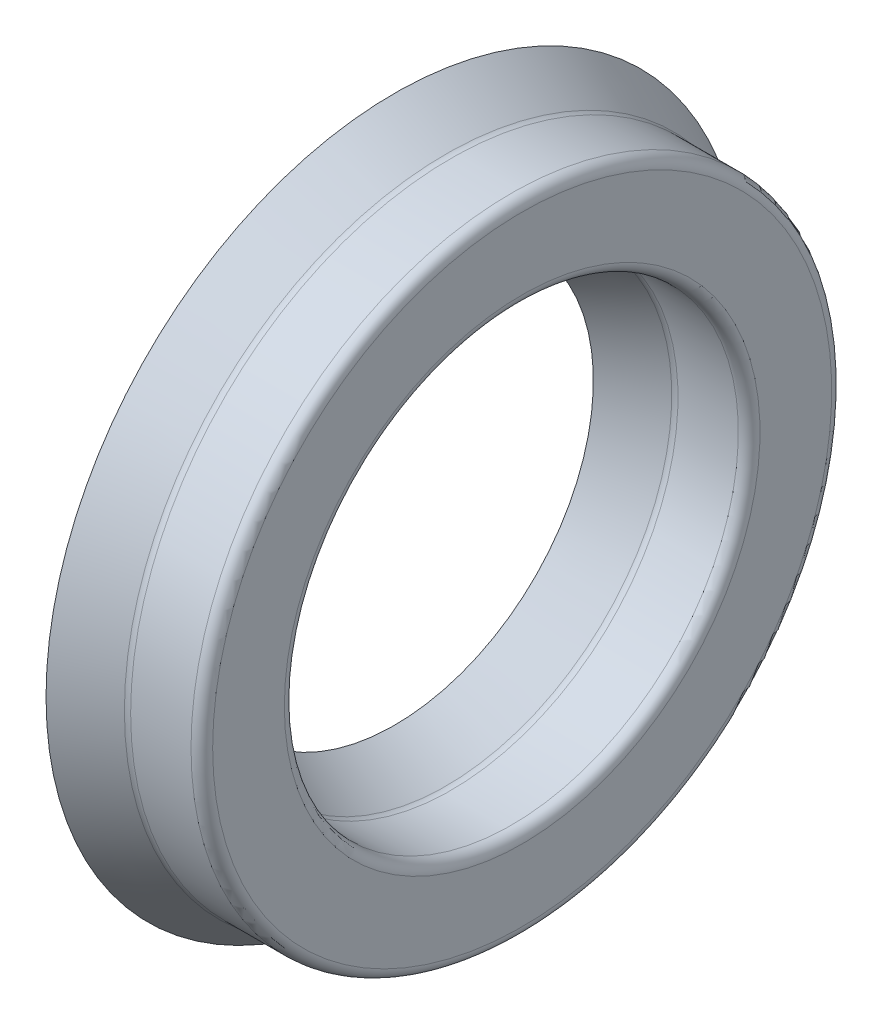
SolidWorks part; units mm, degrees
ref_plane "Front Plane" through (0, 0, 0) normal (0, 0, 1) x (1, 0, 0)
ref_plane "Top Plane" through (0, 0, 0) normal (0, 1, 0) x (1, 0, 0)
ref_plane "Right Plane" through (0, 0, 0) normal (1, 0, 0) x (0, 0, -1)
sketch "Sketch2" plane through (0, 0, 0) normal (0, 0, 1) x (1, 0, 0)
  line L0 (69.1667, 333) -> (345.8333, 333) construction
sketch "Sketch3" plane through (0, 0, 0) normal (0, 0, 1) x (1, 0, 0)
  line L0 (-0.8571, 5.5626) -> (-0.0354, 5.1334)
  line L1 (0.0446, 5.1137) -> (1.0083, 5.1137)
  line L2 (1.1811, 4.9409) -> (1.1811, 3.7967)
  line L3 (1.0083, 3.6239) -> (0.0446, 3.6239)
  line L4 (-0.0354, 3.6042) -> (-0.8571, 3.175)
  line L5 (-0.8571, 3.175) -> (-1.1811, 3.7952)
  line L6 (-1.1811, 3.7952) -> (-0.3763, 4.2156)
  line L7 (-0.3763, 4.522) -> (-1.1811, 4.9424)
  line L8 (-1.1811, 4.9424) -> (-0.8571, 5.5626)
  line L9 (-1.1811, 0) -> (1.1811, 0) construction
  line L10 (-1.1811, 4.9424) -> (-1.1811, 3.7952) construction
  line L11 (-1.1811, 4.3688) -> (1.1811, 4.3688) construction
  line L13 (-0.8571, 5.5626) -> (-0.8571, 3.175) construction
  line L14 (0.5264, 5.1137) -> (0.5264, 3.6239) construction
  arc A0 (0.0446, 3.6239) -> (-0.0354, 3.6042) centre (0.0446, 3.451) ccw
  arc A1 (-0.0354, 5.1334) -> (0.0446, 5.1137) centre (0.0446, 5.2866) ccw
  arc A2 (-0.3763, 4.2156) -> (-0.3763, 4.522) centre (-0.4563, 4.3688) ccw
  arc A3 (1.1811, 3.7967) -> (1.0083, 3.6239) centre (1.0083, 3.7967) cw
  arc A4 (1.0083, 5.1137) -> (1.1811, 4.9409) centre (1.0083, 4.9409) cw
  point P24 (-0.2835, 4.3688)
revolve "Revolve1" add sketch "Sketch3" angle 360 about L9
equation "\"D4@Sketch3\"=(\"OD@Sketch3\"-\"ID@Sketch3\")*.312"
equation "\"D3@Sketch3\"=\"D4@Sketch3\"*.77"
equation "\"D2@Sketch3\"=\"Seal Width@Sketch3\"*.62"
equation "\"D1@Sketch3\"=\"D4@Sketch3\"*.116"
